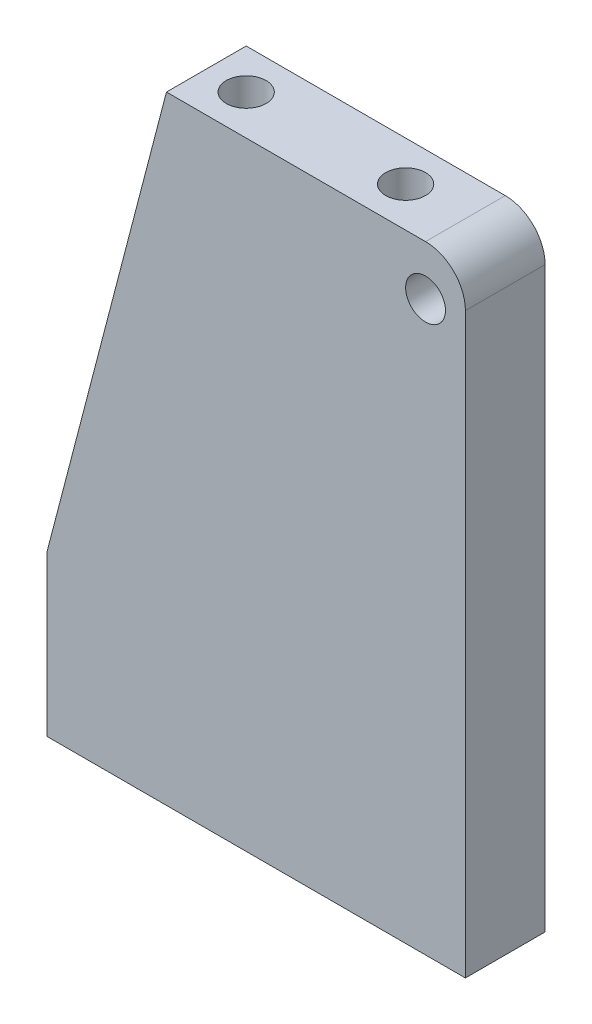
SolidWorks part; units mm, degrees
ref_plane "Front Plane" through (0, 0, 0) normal (0, 0, 1) x (1, 0, 0)
ref_plane "Top Plane" through (0, 0, 0) normal (0, 1, 0) x (1, 0, 0)
ref_plane "Right Plane" through (0, 0, 0) normal (1, 0, 0) x (0, 0, -1)
sketch "Sketch1" plane through (0, 0, 0) normal (0, 0, 1) x (1, 0, 0)
  line L0 (0, 0) -> (33.3375, 0)
  line L1 (33.3375, 0) -> (33.3375, 98.425)
  line L2 (33.3375, 98.425) -> (-33.3375, 98.425)
  line L3 (-33.3375, 98.425) -> (-33.3375, 0)
  line L4 (-33.3375, 0) -> (0, 0)
  line L5 (25.4, 0) -> (25.4, 19.0623) construction
  line L6 (-25.4, 0) -> (-25.4, 19.0623) construction
  line L7 (0, 0) -> (0, 28.2656) construction
  line L8 (-7.9375, 98.425) -> (-7.9375, 64.202) construction
  line L9 (17.4625, 98.425) -> (17.4625, 64.202) construction
  line L10 (-14.2875, 98.425) -> (-33.3375, 25.4)
  circle A0 centre (26.9875, 90.5002) radius 3.175
  dimension "D8" = 6.35
  dimension "D1" = 50.8
  dimension "D2" = 66.675
  dimension "D3" = 98.425
  dimension "D4" = 25.4
  dimension "D5" = 25.4
  dimension "D6" = 7.9248
  dimension "D7" = 6.35
  dimension "D9" = 19.05
  dimension "D10" = 25.4
sketch "Sketch2" plane through (0, 0, 0) normal (0, 0, 1) x (1, 0, 0)
  line L0 (0, 0) -> (33.3375, 0) construction
  line L1 (33.3375, 0) -> (33.3375, 98.425) construction
  line L2 (33.3375, 98.425) -> (-33.3375, 98.425) construction
  line L3 (-33.3375, 98.425) -> (-33.3375, 0) construction
  line L4 (-33.3375, 0) -> (0, 0) construction
  line L5 (0, 0) -> (33.3375, 0)
  line L6 (33.3375, 0) -> (33.3375, 98.425)
  line L7 (33.3375, 98.425) -> (-14.2875, 98.425)
  line L8 (-33.3375, 25.4) -> (-33.3375, 0)
  line L9 (-33.3375, 0) -> (0, 0)
  line L10 (-14.2875, 98.425) -> (-33.3375, 25.4) construction
  line L11 (-14.2875, 98.425) -> (-33.3375, 25.4)
  circle A0 centre (26.9875, 90.5002) radius 3.175 construction
  circle A1 centre (26.9875, 90.5002) radius 3.175
extrude "Boss-Extrude1" add sketch "Sketch2" along normal mid plane 12.7
hole_wizard "5/16 (0.3125) Diameter Hole1" positions "Sketch4" profile "Sketch3" hole size "5/16" standard "ANSI Inch"
sketch "Sketch4" plane through (0, 0, 0) normal (0, -1, 0) x (-1, 0, 0)
  point P0 (25.4, 0)
  point P3 (-25.4, 0)
sketch "Sketch3" plane through (-25.4, 0, 0) normal (1, 0, 0) x (0, 0, -1)
  line L0 (0, 0) -> (0, 21.4347)
  line L1 (0, 21.4347) -> (3.9687, 19.05)
  line L2 (3.9687, 19.05) -> (3.9687, 0)
  line L5 (3.9687, 0) -> (0, 0)
  line L10 (0, 21.4347) -> (-3.9688, 19.05) construction
  line L11 (0, -6.35) -> (0, 107.95) construction
  dimension "Hole Dia." = 7.9375
  dimension "Hole Depth" = 19.05
  dimension "Drill Angle" = 118
hole_wizard "1/4 (0.25) Diameter Hole1" positions "Sketch6" profile "Sketch5" hole size "1/4" standard "ANSI Inch"
sketch "Sketch6" plane through (0, 98.425, 0) normal (0, 1, 0) x (1, 0, 0)
  point P0 (-7.9375, 0)
  point P3 (17.4625, 0)
sketch "Sketch5" plane through (-7.9375, 98.425, 0) normal (1, 0, 0) x (0, 0, 1)
  line L0 (0, 0) -> (0, 20.9577)
  line L1 (0, 20.9577) -> (3.175, 19.05)
  line L2 (3.175, 19.05) -> (3.175, 0)
  line L5 (3.175, 0) -> (0, 0)
  line L10 (0, 20.9577) -> (-3.175, 19.05) construction
  line L11 (0, -6.35) -> (0, 107.95) construction
  dimension "Hole Dia." = 6.35
  dimension "Hole Depth" = 19.05
  dimension "Drill Angle" = 118
fillet "Fillet1" radius 6.35 1 edges at (33.3375, 98.425, 0)
